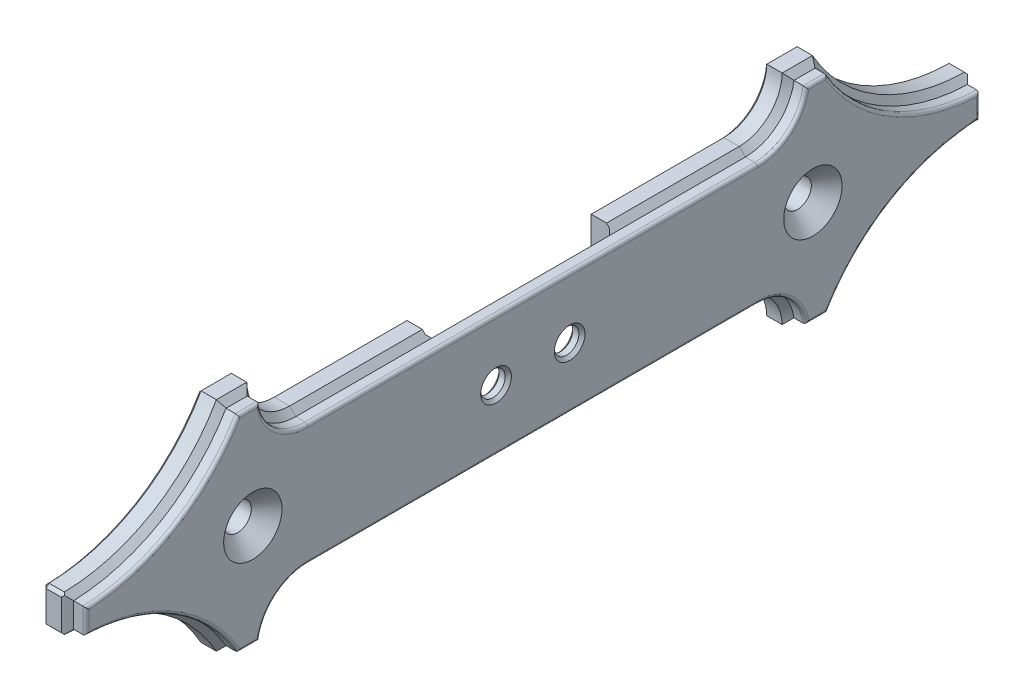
SolidWorks part; units mm, degrees
ref_plane "Спереди" through (0, 0, 0) normal (0, 0, 1) x (1, 0, 0)
ref_plane "Сверху" through (0, 0, 0) normal (0, 1, 0) x (1, 0, 0)
ref_plane "Справа" through (0, 0, 0) normal (1, 0, 0) x (0, 0, -1)
sketch "Эскиз1" plane through (0, 0, 0) normal (1, 0, 0) x (0, 0, -1)
  line L0 (-6, 0) -> (6, 0) construction
  line L1 (6, 0) -> (45.615, 0) construction
  line L2 (-45.615, 0) -> (-6, 0) construction
  line L3 (-73.81, 3) -> (-73.81, -3)
  line L4 (0, 19.1273) -> (0, -19.1273) construction
  line L5 (-45.615, 0) -> (-73.81, 0) construction
  line L6 (-48.5526, 17.75) -> (-43.6136, 17.75)
  line L7 (-36.615, 10.89) -> (36.615, 10.89)
  line L8 (-36.615, -10.89) -> (36.615, -10.89)
  line L9 (-48.5526, -17.75) -> (-43.6136, -17.75)
  line L10 (48.5526, 17.75) -> (43.6136, 17.75)
  line L11 (48.5526, -17.75) -> (43.6136, -17.75)
  line L12 (73.81, 3) -> (73.81, -3)
  circle A0 centre (-6, 0) radius 2
  circle A1 centre (6, 0) radius 2
  circle A2 centre (-45.615, 0) radius 2.25
  circle A3 centre (45.615, 0) radius 2.25
  arc A4 (-43.6136, 17.75) -> (-36.615, 10.89) centre (-36.615, 17.89) ccw
  arc A5 (-73.81, 3) -> (-48.5526, 17.75) centre (-73.81, 32) ccw
  arc A6 (-43.6136, -17.75) -> (-36.615, -10.89) centre (-36.615, -17.89) cw
  arc A7 (-73.81, -3) -> (-48.5526, -17.75) centre (-73.81, -32) cw
  arc A8 (43.6136, -17.75) -> (36.615, -10.89) centre (36.615, -17.89) ccw
  arc A9 (43.6136, 17.75) -> (36.615, 10.89) centre (36.615, 17.89) cw
  arc A10 (73.81, -3) -> (48.5526, -17.75) centre (73.81, -32) ccw
  arc A11 (73.81, 3) -> (48.5526, 17.75) centre (73.81, 32) cw
  point P27 (0, 10.89)
  point P28 (0, -10.89)
  dimension "D2" = 4
  dimension "D3" = 4.5
  dimension "D11" = 9
  dimension "D9" = 14
  dimension "D12" = 58
  dimension "D1" = 12
  dimension "D4" = 91.23
  dimension "D5" = 147.62
  dimension "D6" = 6
  dimension "D7" = 35.5
  dimension "D10" = 21.78
extrude "Бобышка-Вытянуть1" add sketch "Эскиз1" along normal blind 6
sketch "Эскиз2" plane through (6, 0, 0) normal (1, 0, 0) x (0, 0, -1)
  line L0 (-44.5334, 16.75) -> (-47.9752, 16.75)
  line L1 (36.615, 9.89) -> (-36.615, 9.89)
  line L2 (47.9752, 16.75) -> (44.5334, 16.75)
  line L3 (72.81, -2.0167) -> (72.81, 2.0167)
  line L4 (44.5334, -16.75) -> (47.9752, -16.75)
  line L5 (-36.615, -9.89) -> (36.615, -9.89)
  line L6 (-47.9752, -16.75) -> (-44.5334, -16.75)
  line L7 (-72.81, 2.0167) -> (-72.81, -2.0167)
  line L8 (-73.81, 3) -> (-73.81, -3)
  line L9 (-48.5526, -17.75) -> (-43.6136, -17.75)
  line L10 (-36.615, -10.89) -> (36.615, -10.89)
  line L11 (43.6136, -17.75) -> (48.5526, -17.75)
  line L12 (73.81, -3) -> (73.81, 3)
  line L13 (48.5526, 17.75) -> (43.6136, 17.75)
  line L14 (36.615, 10.89) -> (-36.615, 10.89)
  line L15 (-43.6136, 17.75) -> (-48.5526, 17.75)
  line L16 (-73.81, 3) -> (-73.81, -3)
  line L17 (-48.5526, -17.75) -> (-43.6136, -17.75)
  line L18 (-36.615, -10.89) -> (36.615, -10.89)
  line L19 (43.6136, -17.75) -> (48.5526, -17.75)
  line L20 (73.81, -3) -> (73.81, 3)
  line L21 (48.5526, 17.75) -> (43.6136, 17.75)
  line L22 (36.615, 10.89) -> (-36.615, 10.89)
  line L23 (-43.6136, 17.75) -> (-48.5526, 17.75)
  arc A0 (-72.81, 2.0167) -> (-47.9752, 16.75) centre (-73.81, 32) ccw
  arc A1 (-44.5334, 16.75) -> (-36.615, 9.89) centre (-36.615, 17.89) ccw
  arc A2 (36.615, 9.89) -> (44.5334, 16.75) centre (36.615, 17.89) ccw
  arc A3 (47.9752, 16.75) -> (72.81, 2.0167) centre (73.81, 32) ccw
  arc A4 (72.81, -2.0167) -> (47.9752, -16.75) centre (73.81, -32) ccw
  arc A5 (44.5334, -16.75) -> (36.615, -9.89) centre (36.615, -17.89) ccw
  arc A6 (-36.615, -9.89) -> (-44.5334, -16.75) centre (-36.615, -17.89) ccw
  arc A7 (-47.9752, -16.75) -> (-72.81, -2.0167) centre (-73.81, -32) ccw
  arc A8 (-73.81, 3) -> (-48.5526, 17.75) centre (-73.81, 32) ccw
  arc A9 (-48.5526, -17.75) -> (-73.81, -3) centre (-73.81, -32) ccw
  arc A10 (-36.615, -10.89) -> (-43.6136, -17.75) centre (-36.615, -17.89) ccw
  arc A11 (43.6136, -17.75) -> (36.615, -10.89) centre (36.615, -17.89) ccw
  arc A12 (73.81, -3) -> (48.5526, -17.75) centre (73.81, -32) ccw
  arc A13 (48.5526, 17.75) -> (73.81, 3) centre (73.81, 32) ccw
  arc A14 (36.615, 10.89) -> (43.6136, 17.75) centre (36.615, 17.89) ccw
  arc A15 (-43.6136, 17.75) -> (-36.615, 10.89) centre (-36.615, 17.89) ccw
  arc A16 (-73.81, 3) -> (-48.5526, 17.75) centre (-73.81, 32) ccw
  arc A17 (-48.5526, -17.75) -> (-73.81, -3) centre (-73.81, -32) ccw
  arc A18 (-36.615, -10.89) -> (-43.6136, -17.75) centre (-36.615, -17.89) ccw
  arc A19 (43.6136, -17.75) -> (36.615, -10.89) centre (36.615, -17.89) ccw
  arc A20 (73.81, -3) -> (48.5526, -17.75) centre (73.81, -32) ccw
  arc A21 (48.5526, 17.75) -> (73.81, 3) centre (73.81, 32) ccw
  arc A22 (36.615, 10.89) -> (43.6136, 17.75) centre (36.615, 17.89) ccw
  arc A23 (-43.6136, 17.75) -> (-36.615, 10.89) centre (-36.615, 17.89) ccw
  dimension "D1" = 0
  dimension "D2" = 1
extrude "Вырез-Вытянуть1" cut sketch "Эскиз2" against normal blind 2
fillet "Скругление1" radius 0.5 16 edges at (6, -11.8435, -41.8533) (6, -9.89, 0) (6, 11.8435, -41.8533) (6, 11.8435, 41.8533) (6, -16.75, -46.2543) (6, -6.1987, -58.5033) (6, 0, -72.81) (6, 6.1987, -58.5033) (6, 16.75, -46.2543) (6, -11.8435, 41.8533) (6, -16.75, 46.2543) (6, -6.1987, 58.5033) (6, 0, 72.81) (6, 6.1987, 58.5033) (6, 16.75, 46.2543) (6, 9.89, 0)
chamfer "Фаска1" distance 1 angle 45 16 edges at (4, -12.891, -41.515) (4, -10.89, 0) (4, -12.891, 41.515) (4, -17.75, 46.0831) (4, -6.9575, 59.1855) (4, 0, 73.81) (4, 6.9575, 59.1855) (4, 17.75, 46.0831) (4, -17.75, -46.0831) (4, -6.9575, -59.1855) (4, 0, -73.81) (4, 6.9575, -59.1855) (4, 17.75, -46.0831) (4, 12.891, -41.515) (4, 12.891, 41.515) (4, 10.89, 0)
sketch "Эскиз3" plane through (0, 0, 0) normal (1, 0, 0) x (0, 0, -1)
  line L0 (36.615, -10.89) -> (-36.615, -10.89) construction
  line L1 (15, 10.89) -> (-15, 10.89)
  line L2 (15, 10.89) -> (15, -10.89)
  line L3 (15, -10.89) -> (-15, -10.89)
  line L4 (-15, 10.89) -> (-15, -10.89)
  line L5 (15, 10.89) -> (-15, -10.89) construction
  line L6 (15, -10.89) -> (-15, 10.89) construction
  point P0 (0, 0)
  dimension "D1" = 30
extrude "Вырез-Вытянуть2" cut sketch "Эскиз3" along normal blind 4
chamfer "Фаска2" distance 0.5 angle 45 32 edges at (4, 0, 8) (6, 0, 4) (4, 0, -4) (6, 0, -8) (0, -10.89, -25.8075) (0, -12.891, -41.515) (0, -17.75, -46.0831) (0, -6.9575, -59.1855) (0, 0, -73.81) (0, 6.9575, -59.1855) (0, 17.75, -46.0831) (0, 12.891, -41.515) (0, 0, -15) (0, 10.89, -25.8075) (0, -10.89, 25.8075) (0, -12.891, 41.515) (0, -17.75, 46.0831) (0, -6.9575, 59.1855) (0, 0, 73.81) (0, 6.9575, 59.1855) (0, 17.75, 46.0831) (0, 12.891, 41.515) (0, 0, 15) (0, 10.89, 25.8075) (0, 0, -47.865) (0, 0, 43.365) (4, 0, -15) (4, 0, 15) (1.5, -3, -73.81) (1.5, 3, -73.81) (1.5, -3, 73.81) (1.5, 3, 73.81)
chamfer "Фаска3" distance 2.5 angle 45 2 edges at (6, 0, -47.865) (6, 0, 43.365)
